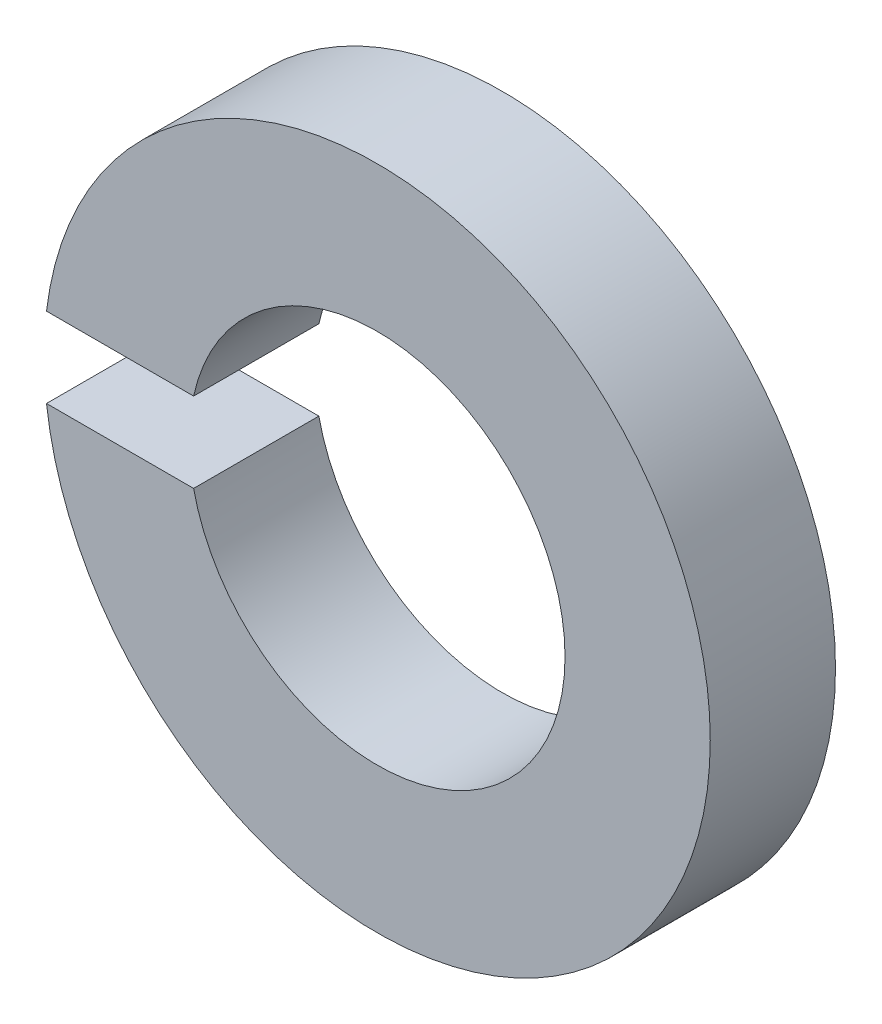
SolidWorks part; units mm, degrees
ref_plane "Front Plane" through (0, 0, 0) normal (0, 0, 1) x (1, 0, 0)
ref_plane "Top Plane" through (0, 0, 0) normal (0, 1, 0) x (1, 0, 0)
ref_plane "Right Plane" through (0, 0, 0) normal (1, 0, 0) x (0, 0, -1)
sketch "Sketch2" plane through (0, 0, 0) normal (0, 0, 1) x (1, 0, 0)
  line L1 (-1.7497, 0.381) -> (-3.1521, 0.381)
  line L2 (-1.7497, -0.381) -> (-3.1521, -0.381)
  arc A0 (-1.7497, -0.381) -> (-1.7497, 0.381) centre (0, 0) ccw
  arc A1 (-3.1521, -0.381) -> (-3.1521, 0.381) centre (0, 0) ccw
  dimension "D1" = 3.5814
  dimension "D2" = 6.35
extrude "Boss-Extrude1" add sketch "Sketch2" along normal blind 1.1938
